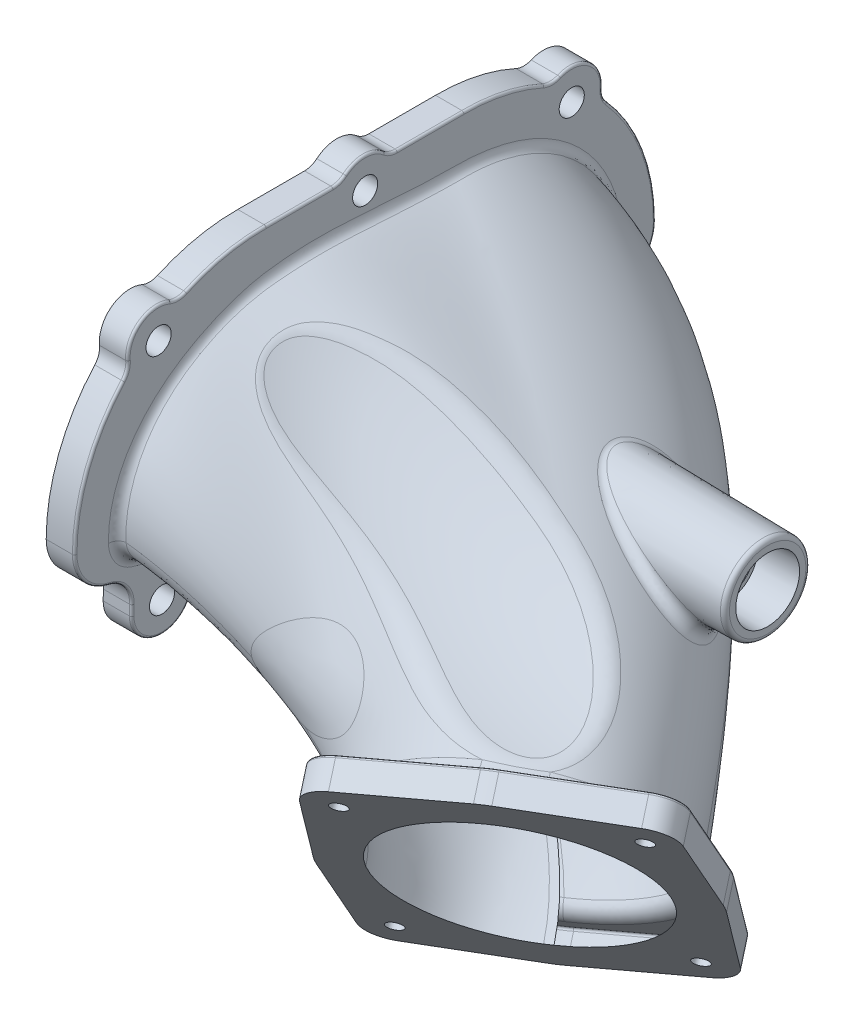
SolidWorks part; units mm, degrees
ref_plane "Front" through (0, 0, 0) normal (0, 0, 1) x (1, 0, 0)
ref_plane "Top" through (0, 0, 0) normal (0, 1, 0) x (1, 0, 0)
ref_plane "Right" through (0, 0, 0) normal (1, 0, 0) x (0, 0, -1)
imported_body "Surface-Imported1"
imported_body "Surface-Imported2"
surface "Surface-Fill5" [suppressed]
sketch3d "3DSketch1"
  spline S14 degree 3 poles (1005.4638, 90.7321, -1757.311) (-176.2378, 115.1326, 176.487) (-12.4549, 97.9545, -3.8592) (94.6916, 38.5251, 14.2017) (96.1386, 37.7085, 14.4851) (98.9931, 36.068, 15.1336) (100.4025, 35.2431, 15.4988) (103.1841, 33.5858, 16.3193) (104.5566, 32.753, 16.7732) (108.6137, 30.2506, 18.2931) (111.2382, 28.578, 19.5196) (114.417, 26.5056, 21.363) (115.0468, 26.0926, 21.7471) (116.2852, 25.2762, 22.5409) (116.895, 24.8721, 22.9515) (118.6963, 23.6727, 24.2255) (119.8596, 22.8907, 25.1307) (122.1072, 21.3685, 27.0627) (123.1917, 20.6282, 28.0894) (125.2731, 19.1973, 30.2798) (126.2703, 18.5067, 31.4433) (128.1603, 17.1843, 33.9339) (129.035, 16.5654, 35.2375) (130.6178, 15.421, 37.9714) (131.3253, 14.8961, 39.4036) (132.2375, 14.1784, 41.662) (132.5171, 13.9502, 42.4359) (133.0103, 13.5255, 43.9982) (133.2251, 13.3281, 44.7892) (133.5844, 12.9632, 46.3921) (133.729, 12.7957, 47.2041) (133.8862, 12.5672, 48.4392) (133.9286, 12.4949, 48.8538) (133.976, 12.392, 49.4803) (133.9885, 12.3592, 49.6901) (134.0124, 12.2923, 50.1097) (134.0215, 12.2599, 50.3203) (134.0757, 11.9802, 52.2119) (133.9337, 11.8097, 53.884) (133.459, 11.6801, 55.9556) (133.3491, 11.6585, 56.3678) (133.1013, 11.6237, 57.1782) (132.9631, 11.6105, 57.5776) (113.0604, 10.3877, 108.8555) (-149.8951, 72.9629, 63.1594) (-1742.5609, -341.9546, -528.6619) knots -4.473367 -4.473367 -4.473367 -4.473367 0.0625 0.0625 0.125 0.125 0.1875 0.1875 0.25 0.25 0.375 0.375 0.40625 0.40625 0.4375 0.4375 0.5 0.5 0.5625 0.5625 0.625 0.625 0.6875 0.6875 0.75 0.75 0.78125 0.78125 0.8125 0.8125 0.84375 0.84375 0.859375 0.859375 0.867188 0.867188 0.875 0.875 0.9375 0.9375 0.953125 0.953125 0.96875 0.96875 2.988263 2.988263 2.988263 2.988263 only from (88.8369, 41.7325, 13.3266) to (131.7147, 11.5886, 60.2624) construction
  spline S15 degree 3 poles (1560.0444, -661.8859, -1009.8542) (26.3725, 31.3471, 133.1526) (5.2586, 75.1866, 58.3706) (23.2367, 73.3857, 31.5766) (23.4803, 73.354, 31.2323) (24.2303, 73.2374, 30.2205) (24.756, 73.1315, 29.574) (25.8506, 72.8725, 28.3282) (26.4196, 72.7193, 27.729) (27.3025, 72.458, 26.8623) (27.6018, 72.3656, 26.5787) (28.21, 72.1708, 26.0221) (28.5195, 72.0682, 25.7486) (30.0778, 71.5359, 24.4174) (31.3663, 71.0467, 23.4616) (33.0243, 70.3889, 22.3739) (33.3585, 70.2548, 22.1623) (34.0279, 69.9853, 21.7414) (34.3635, 69.8494, 21.5331) (35.3731, 69.4377, 20.9156) (36.0499, 69.1576, 20.5135) (37.4115, 68.5833, 19.7318) (38.0963, 68.2889, 19.3521) (39.474, 67.6836, 18.6168) (40.1666, 67.3727, 18.2605) (41.566, 66.7301, 17.5848) (42.2737, 66.3984, 17.2631) (43.6907, 65.7228, 16.6563) (44.4007, 65.3786, 16.3707) (47.9588, 63.6305, 15.0236) (50.8316, 62.147, 14.204) (55.1842, 59.8589, 13.2549) (56.6423, 59.0854, 12.9857) (59.571, 57.522, 12.5248) (61.0437, 56.731, 12.3339) (63.9792, 55.1474, 12.027) (65.4445, 54.3529, 11.9073) (68.3718, 52.7631, 11.7587) (69.8341, 51.9681, 11.7282) (74.2204, 49.5883, 11.7467) (77.1445, 48.0096, 11.9033) (81.5313, 45.6524, 12.3078) (82.9935, 44.8683, 12.4714) (85.1859, 43.6926, 12.7596) (85.9165, 43.3007, 12.8628) (87.012, 42.7129, 13.0284) (87.5597, 42.4189, 13.114) (88.1984, 42.0757, 13.2186) (88.4721, 41.9286, 13.2645) (94.8892, 38.4791, 14.3491) (92.7862, 39.5725, 14.5385) (1829.9537, -894.8471, 313.9282) knots -1.15725 -1.15725 -1.15725 -1.15725 0.015625 0.015625 0.03125 0.03125 0.0625 0.0625 0.09375 0.09375 0.109375 0.109375 0.125 0.125 0.1875 0.1875 0.203125 0.203125 0.21875 0.21875 0.25 0.25 0.28125 0.28125 0.3125 0.3125 0.34375 0.34375 0.375 0.375 0.5 0.5 0.5625 0.5625 0.625 0.625 0.6875 0.6875 0.75 0.75 0.875 0.875 0.9375 0.9375 0.96875 0.96875 0.984375 0.992188 0.996094 0.996094 1.266983 1.266983 1.266983 1.266983 only from (22.3154, 73.4547, 33.0084) to (88.8369, 41.7325, 13.3266) construction
  spline S16 degree 3 number of poles 66 (90.3339, 16.9796, 64.9298) -> (22.3154, 73.4547, 33.0084) construction
  spline S17 degree 3 poles (614.0407, -516.8384, -1782.8452) (-67.2549, 673.7387, 1944.5989) (162.8848, -841.8006, -1736.3681) (-180.3872, 1157.455, 1676.758) knots -60.468019 -60.468019 -60.468019 -60.468019 62.622658 62.622658 62.622658 62.622658 only from (93.8118, 16.1005, 66.2329) to (90.3339, 16.9796, 64.9298) construction
  spline S18 degree 3 poles (179.8986, -144.845, -1921.1643) (226.4149, 10.6921, -73.3699) (172.0875, 6.9146, 70.0831) (110.741, 13.536, 69.7961) (109.7127, 13.6493, 69.7496) (107.6534, 13.8849, 69.5808) (106.631, 14.0074, 69.4579) (103.592, 14.3928, 68.9945) (101.5992, 14.6739, 68.5596) (98.6501, 15.1559, 67.7753) (97.6738, 15.3267, 67.4917) (96.2187, 15.6017, 67.0388) (95.7352, 15.6966, 66.8832) (95.0123, 15.844, 66.6438) (94.7717, 15.894, 66.563) (74.5226, 20.1867, 59.6677) (49.338, 32.4582, 43.4536) (1947.2505, -345.8185, 724.6333) knots -7.09543 -7.09543 -7.09543 -7.09543 0.25 0.25 0.375 0.375 0.5 0.5 0.75 0.75 0.875 0.875 0.9375 0.9375 0.96875 0.96875 3.571466 3.571466 3.571466 3.571466 only from (117.9019, 12.7895, 69.2687) to (93.8118, 16.1005, 66.2329) construction
  spline S19 degree 3 poles (-212.9602, -1941.9259, -165.3836) (128.9641, -35.1742, -86.7086) (169.434, 6.2954, 30.0082) (128.1146, 12.2402, 63.4948) (127.561, 12.3112, 63.9172) (126.4365, 12.4416, 64.726) (125.8645, 12.5011, 65.1136) (124.121, 12.6618, 66.2298) (122.9227, 12.7455, 66.9125) (67.2671, 14.7855, 95.3679) (-50.8018, -59.1415, 17.8966) (-282.9748, -1935.4604, -89.7529) knots -9.203255 -9.203255 -9.203255 -9.203255 0.25 0.25 0.375 0.375 0.5 0.5 0.75 0.75 11.806093 11.806093 11.806093 11.806093 only from (131.7147, 11.5886, 60.2624) to (117.9019, 12.7895, 69.2687) construction
  spline S20 degree 3 poles (88.8369, 41.7325, 13.3266) (90.3116, 40.9405, 13.5028) (91.779, 40.1406, 13.7107) (94.6916, 38.5251, 14.2017) (96.1386, 37.7085, 14.4851) (98.9931, 36.068, 15.1336) (100.4025, 35.2431, 15.4988) (103.1841, 33.5858, 16.3193) (104.5566, 32.753, 16.7732) (108.6137, 30.2506, 18.2931) (111.2382, 28.578, 19.5196) (114.417, 26.5056, 21.363) (115.0468, 26.0926, 21.7471) (116.2852, 25.2762, 22.5409) (116.895, 24.8721, 22.9515) (118.6963, 23.6727, 24.2255) (119.8596, 22.8907, 25.1307) (122.1072, 21.3685, 27.0627) (123.1917, 20.6282, 28.0894) (125.2731, 19.1973, 30.2798) (126.2703, 18.5067, 31.4433) (128.1603, 17.1843, 33.9339) (129.035, 16.5654, 35.2375) (130.6178, 15.421, 37.9714) (131.3253, 14.8961, 39.4036) (132.2375, 14.1784, 41.662) (132.5171, 13.9502, 42.4359) (133.0103, 13.5255, 43.9982) (133.2251, 13.3281, 44.7892) (133.5844, 12.9632, 46.3921) (133.729, 12.7957, 47.2041) (133.8862, 12.5672, 48.4392) (133.9286, 12.4949, 48.8538) (133.976, 12.392, 49.4803) (133.9885, 12.3592, 49.6901) (134.0124, 12.2923, 50.1097) (134.0215, 12.2599, 50.3203) (134.0757, 11.9802, 52.2119) (133.9337, 11.8097, 53.884) (133.459, 11.6801, 55.9556) (133.3491, 11.6585, 56.3678) (133.1013, 11.6237, 57.1782) (132.9631, 11.6105, 57.5776) (132.5047, 11.5824, 58.7587) (132.1408, 11.5789, 59.523) (131.7147, 11.5886, 60.2624) knots 0 0 0 0 0.0625 0.0625 0.125 0.125 0.1875 0.1875 0.25 0.25 0.375 0.375 0.40625 0.40625 0.4375 0.4375 0.5 0.5 0.5625 0.5625 0.625 0.625 0.6875 0.6875 0.75 0.75 0.78125 0.78125 0.8125 0.8125 0.84375 0.84375 0.859375 0.859375 0.867188 0.867188 0.875 0.875 0.9375 0.9375 0.953125 0.953125 0.96875 0.96875 1 1 1 1
  spline S21 degree 3 poles (22.3154, 73.4547, 33.0084) (22.5345, 73.4487, 32.642) (22.764, 73.4331, 32.2811) (23.2367, 73.3857, 31.5766) (23.4803, 73.354, 31.2323) (24.2303, 73.2374, 30.2205) (24.756, 73.1315, 29.574) (25.8506, 72.8725, 28.3282) (26.4196, 72.7193, 27.729) (27.3025, 72.458, 26.8623) (27.6018, 72.3656, 26.5787) (28.21, 72.1708, 26.0221) (28.5195, 72.0682, 25.7486) (30.0778, 71.5359, 24.4174) (31.3663, 71.0467, 23.4616) (33.0243, 70.3889, 22.3739) (33.3585, 70.2548, 22.1623) (34.0279, 69.9853, 21.7414) (34.3635, 69.8494, 21.5331) (35.3731, 69.4377, 20.9156) (36.0499, 69.1576, 20.5135) (37.4115, 68.5833, 19.7318) (38.0963, 68.2889, 19.3521) (39.474, 67.6836, 18.6168) (40.1666, 67.3727, 18.2605) (41.566, 66.7301, 17.5848) (42.2737, 66.3984, 17.2631) (43.6907, 65.7228, 16.6563) (44.4007, 65.3786, 16.3707) (47.9588, 63.6305, 15.0236) (50.8316, 62.147, 14.204) (55.1842, 59.8589, 13.2549) (56.6423, 59.0854, 12.9857) (59.571, 57.522, 12.5248) (61.0437, 56.731, 12.3339) (63.9792, 55.1474, 12.027) (65.4445, 54.3529, 11.9073) (68.3718, 52.7631, 11.7587) (69.8341, 51.9681, 11.7282) (74.2204, 49.5883, 11.7467) (77.1445, 48.0096, 11.9033) (81.5313, 45.6524, 12.3078) (82.9935, 44.8683, 12.4714) (85.1859, 43.6926, 12.7596) (85.9165, 43.3007, 12.8628) (87.012, 42.7129, 13.0284) (87.5597, 42.4189, 13.114) (88.1984, 42.0757, 13.2186) (88.4721, 41.9286, 13.2645) (88.6545, 41.8306, 13.2954) (88.744, 41.7825, 13.3106) (88.8369, 41.7325, 13.3266) knots 0 0 0 0 0.015625 0.015625 0.03125 0.03125 0.0625 0.0625 0.09375 0.09375 0.109375 0.109375 0.125 0.125 0.1875 0.1875 0.203125 0.203125 0.21875 0.21875 0.25 0.25 0.28125 0.28125 0.3125 0.3125 0.34375 0.34375 0.375 0.375 0.5 0.5 0.5625 0.5625 0.625 0.625 0.6875 0.6875 0.75 0.75 0.875 0.875 0.9375 0.9375 0.96875 0.96875 0.984375 0.992188 0.996094 0.996094 1 1 1 1
  spline S22 degree 3 number of poles 66 (90.3339, 16.9796, 64.9298) -> (22.3154, 73.4547, 33.0084)
  spline S23 degree 3 poles (93.8118, 16.1005, 66.2329) (92.6408, 16.3693, 65.8147) (91.4817, 16.6612, 65.3777) (90.3339, 16.9796, 64.9298) knots 0 0 0 0 1 1 1 1
  spline S24 degree 3 poles (117.9019, 12.7895, 69.2687) (115.8665, 12.9939, 69.6536) (113.8205, 13.2036, 69.8105) (110.741, 13.536, 69.7961) (109.7127, 13.6493, 69.7496) (107.6534, 13.8849, 69.5808) (106.631, 14.0074, 69.4579) (103.592, 14.3928, 68.9945) (101.5992, 14.6739, 68.5596) (98.6501, 15.1559, 67.7753) (97.6738, 15.3267, 67.4917) (96.2187, 15.6017, 67.0388) (95.7352, 15.6966, 66.8832) (95.0123, 15.844, 66.6438) (94.7717, 15.894, 66.563) (94.2912, 15.9959, 66.3993) (94.0502, 16.048, 66.3162) (93.8118, 16.1005, 66.2329) knots 0 0 0 0 0.25 0.25 0.375 0.375 0.5 0.5 0.75 0.75 0.875 0.875 0.9375 0.9375 0.96875 0.96875 1 1 1 1
  spline S25 degree 3 poles (131.7147, 11.5886, 60.2624) (130.754, 11.8274, 61.2513) (129.7323, 12.0075, 62.1838) (128.1146, 12.2402, 63.4948) (127.561, 12.3112, 63.9172) (126.4365, 12.4416, 64.726) (125.8645, 12.5011, 65.1136) (124.121, 12.6618, 66.2298) (122.9227, 12.7455, 66.9125) (120.4614, 12.8357, 68.1709) (119.1982, 12.842, 68.7463) (117.9019, 12.7895, 69.2687) knots 0 0 0 0 0.25 0.25 0.375 0.375 0.5 0.5 0.75 0.75 1 1 1 1
sketch3d "3DSketch2" [suppressed]
  spline S1 degree 3 number of poles 83 (94.4414, 20.1638, 58.2469) -> (94.4414, 20.1638, 58.2469)
  spline S2 degree 3 number of poles 83 (94.4414, 20.1638, 58.2469) -> (94.4414, 20.1638, 58.2469)
  dimension "D1" = 0
surface "Surface-Fill6" [suppressed]
other "DeleteFace1"
surface "Surface-Fill7"
surface "Surface-Fill8"
sketch3d "3DSketch3"
  spline S0 degree 3 poles (1560.0444, -661.8859, -1009.8542) (26.3725, 31.3471, 133.1526) (5.2586, 75.1866, 58.3706) (23.2367, 73.3857, 31.5766) (23.4803, 73.354, 31.2323) (24.2303, 73.2374, 30.2205) (24.756, 73.1315, 29.574) (25.8506, 72.8725, 28.3282) (26.4196, 72.7193, 27.729) (27.3025, 72.458, 26.8623) (27.6018, 72.3656, 26.5787) (28.21, 72.1708, 26.0221) (28.5195, 72.0682, 25.7486) (30.0778, 71.5359, 24.4174) (31.3663, 71.0467, 23.4616) (33.0243, 70.3889, 22.3739) (33.3585, 70.2548, 22.1623) (34.0279, 69.9853, 21.7414) (34.3635, 69.8494, 21.5331) (35.3731, 69.4377, 20.9156) (36.0499, 69.1576, 20.5135) (37.4115, 68.5833, 19.7318) (38.0963, 68.2889, 19.3521) (39.474, 67.6836, 18.6168) (40.1666, 67.3727, 18.2605) (41.566, 66.7301, 17.5848) (42.2737, 66.3984, 17.2631) (43.6907, 65.7228, 16.6563) (44.4007, 65.3786, 16.3707) (47.9588, 63.6305, 15.0236) (50.8316, 62.147, 14.204) (55.1842, 59.8589, 13.2549) (56.6423, 59.0854, 12.9857) (59.571, 57.522, 12.5248) (61.0437, 56.731, 12.3339) (63.9792, 55.1474, 12.027) (65.4445, 54.3529, 11.9073) (68.3718, 52.7631, 11.7587) (69.8341, 51.9681, 11.7282) (74.2204, 49.5883, 11.7467) (77.1445, 48.0096, 11.9033) (81.5313, 45.6524, 12.3078) (82.9935, 44.8683, 12.4714) (85.1859, 43.6926, 12.7596) (85.9165, 43.3007, 12.8628) (87.012, 42.7129, 13.0284) (87.5597, 42.4189, 13.114) (88.1984, 42.0757, 13.2186) (88.4721, 41.9286, 13.2645) (94.8892, 38.4791, 14.3491) (92.7862, 39.5725, 14.5385) (1829.9537, -894.8471, 313.9282) knots -1.15725 -1.15725 -1.15725 -1.15725 0.015625 0.015625 0.03125 0.03125 0.0625 0.0625 0.09375 0.09375 0.109375 0.109375 0.125 0.125 0.1875 0.1875 0.203125 0.203125 0.21875 0.21875 0.25 0.25 0.28125 0.28125 0.3125 0.3125 0.34375 0.34375 0.375 0.375 0.5 0.5 0.5625 0.5625 0.625 0.625 0.6875 0.6875 0.75 0.75 0.875 0.875 0.9375 0.9375 0.96875 0.96875 0.984375 0.992188 0.996094 0.996094 1.266983 1.266983 1.266983 1.266983 only from (22.3154, 73.4547, 33.0084) to (88.8369, 41.7325, 13.3266) construction
  spline S1 degree 3 poles (1005.4638, 90.7321, -1757.311) (-176.2378, 115.1326, 176.487) (-12.4549, 97.9545, -3.8592) (94.6916, 38.5251, 14.2017) (96.1386, 37.7085, 14.4851) (98.9931, 36.068, 15.1336) (100.4025, 35.2431, 15.4988) (103.1841, 33.5858, 16.3193) (104.5566, 32.753, 16.7732) (108.6137, 30.2506, 18.2931) (111.2382, 28.578, 19.5196) (114.417, 26.5056, 21.363) (115.0468, 26.0926, 21.7471) (116.2852, 25.2762, 22.5409) (116.895, 24.8721, 22.9515) (118.6963, 23.6727, 24.2255) (119.8596, 22.8907, 25.1307) (122.1072, 21.3685, 27.0627) (123.1917, 20.6282, 28.0894) (125.2731, 19.1973, 30.2798) (126.2703, 18.5067, 31.4433) (128.1603, 17.1843, 33.9339) (129.035, 16.5654, 35.2375) (130.6178, 15.421, 37.9714) (131.3253, 14.8961, 39.4036) (132.2375, 14.1784, 41.662) (132.5171, 13.9502, 42.4359) (133.0103, 13.5255, 43.9982) (133.2251, 13.3281, 44.7892) (133.5844, 12.9632, 46.3921) (133.729, 12.7957, 47.2041) (133.8862, 12.5672, 48.4392) (133.9286, 12.4949, 48.8538) (133.976, 12.392, 49.4803) (133.9885, 12.3592, 49.6901) (134.0124, 12.2923, 50.1097) (134.0215, 12.2599, 50.3203) (134.0757, 11.9802, 52.2119) (133.9337, 11.8097, 53.884) (133.459, 11.6801, 55.9556) (133.3491, 11.6585, 56.3678) (133.1013, 11.6237, 57.1782) (132.9631, 11.6105, 57.5776) (113.0604, 10.3877, 108.8555) (-149.8951, 72.9629, 63.1594) (-1742.5609, -341.9546, -528.6619) knots -4.473367 -4.473367 -4.473367 -4.473367 0.0625 0.0625 0.125 0.125 0.1875 0.1875 0.25 0.25 0.375 0.375 0.40625 0.40625 0.4375 0.4375 0.5 0.5 0.5625 0.5625 0.625 0.625 0.6875 0.6875 0.75 0.75 0.78125 0.78125 0.8125 0.8125 0.84375 0.84375 0.859375 0.859375 0.867188 0.867188 0.875 0.875 0.9375 0.9375 0.953125 0.953125 0.96875 0.96875 2.988263 2.988263 2.988263 2.988263 only from (88.8369, 41.7325, 13.3266) to (131.7147, 11.5886, 60.2624) construction
  spline S2 degree 3 number of poles 66 (90.3339, 16.9796, 64.9298) -> (22.3154, 73.4547, 33.0084) construction
  spline S3 degree 3 poles (614.0407, -516.8384, -1782.8452) (-67.2549, 673.7387, 1944.5989) (162.8848, -841.8006, -1736.3681) (-180.3872, 1157.455, 1676.758) knots -60.468019 -60.468019 -60.468019 -60.468019 62.622658 62.622658 62.622658 62.622658 only from (93.8118, 16.1005, 66.2329) to (90.3339, 16.9796, 64.9298) construction
  spline S4 degree 3 poles (179.8986, -144.845, -1921.1643) (226.4149, 10.6921, -73.3699) (172.0875, 6.9146, 70.0831) (110.741, 13.536, 69.7961) (109.7127, 13.6493, 69.7496) (107.6534, 13.8849, 69.5808) (106.631, 14.0074, 69.4579) (103.592, 14.3928, 68.9945) (101.5992, 14.6739, 68.5596) (98.6501, 15.1559, 67.7753) (97.6738, 15.3267, 67.4917) (96.2187, 15.6017, 67.0388) (95.7352, 15.6966, 66.8832) (95.0123, 15.844, 66.6438) (94.7717, 15.894, 66.563) (74.5226, 20.1867, 59.6677) (49.338, 32.4582, 43.4536) (1947.2505, -345.8185, 724.6333) knots -7.09543 -7.09543 -7.09543 -7.09543 0.25 0.25 0.375 0.375 0.5 0.5 0.75 0.75 0.875 0.875 0.9375 0.9375 0.96875 0.96875 3.571466 3.571466 3.571466 3.571466 only from (117.9019, 12.7895, 69.2687) to (93.8118, 16.1005, 66.2329) construction
  spline S5 degree 3 poles (-212.9602, -1941.9259, -165.3836) (128.9641, -35.1742, -86.7086) (169.434, 6.2954, 30.0082) (128.1146, 12.2402, 63.4948) (127.561, 12.3112, 63.9172) (126.4365, 12.4416, 64.726) (125.8645, 12.5011, 65.1136) (124.121, 12.6618, 66.2298) (122.9227, 12.7455, 66.9125) (67.2671, 14.7855, 95.3679) (-50.8018, -59.1415, 17.8966) (-282.9748, -1935.4604, -89.7529) knots -9.203255 -9.203255 -9.203255 -9.203255 0.25 0.25 0.375 0.375 0.5 0.5 0.75 0.75 11.806093 11.806093 11.806093 11.806093 only from (131.7147, 11.5886, 60.2624) to (117.9019, 12.7895, 69.2687) construction
  spline S6 degree 3 poles (22.3154, 73.4547, 33.0084) (22.5345, 73.4487, 32.642) (22.764, 73.4331, 32.2811) (23.2367, 73.3857, 31.5766) (23.4803, 73.354, 31.2323) (24.2303, 73.2374, 30.2205) (24.756, 73.1315, 29.574) (25.8506, 72.8725, 28.3282) (26.4196, 72.7193, 27.729) (27.3025, 72.458, 26.8623) (27.6018, 72.3656, 26.5787) (28.21, 72.1708, 26.0221) (28.5195, 72.0682, 25.7486) (30.0778, 71.5359, 24.4174) (31.3663, 71.0467, 23.4616) (33.0243, 70.3889, 22.3739) (33.3585, 70.2548, 22.1623) (34.0279, 69.9853, 21.7414) (34.3635, 69.8494, 21.5331) (35.3731, 69.4377, 20.9156) (36.0499, 69.1576, 20.5135) (37.4115, 68.5833, 19.7318) (38.0963, 68.2889, 19.3521) (39.474, 67.6836, 18.6168) (40.1666, 67.3727, 18.2605) (41.566, 66.7301, 17.5848) (42.2737, 66.3984, 17.2631) (43.6907, 65.7228, 16.6563) (44.4007, 65.3786, 16.3707) (47.9588, 63.6305, 15.0236) (50.8316, 62.147, 14.204) (55.1842, 59.8589, 13.2549) (56.6423, 59.0854, 12.9857) (59.571, 57.522, 12.5248) (61.0437, 56.731, 12.3339) (63.9792, 55.1474, 12.027) (65.4445, 54.3529, 11.9073) (68.3718, 52.7631, 11.7587) (69.8341, 51.9681, 11.7282) (74.2204, 49.5883, 11.7467) (77.1445, 48.0096, 11.9033) (81.5313, 45.6524, 12.3078) (82.9935, 44.8683, 12.4714) (85.1859, 43.6926, 12.7596) (85.9165, 43.3007, 12.8628) (87.012, 42.7129, 13.0284) (87.5597, 42.4189, 13.114) (88.1984, 42.0757, 13.2186) (88.4721, 41.9286, 13.2645) (88.6545, 41.8306, 13.2954) (88.744, 41.7825, 13.3106) (88.8369, 41.7325, 13.3266) knots 0 0 0 0 0.015625 0.015625 0.03125 0.03125 0.0625 0.0625 0.09375 0.09375 0.109375 0.109375 0.125 0.125 0.1875 0.1875 0.203125 0.203125 0.21875 0.21875 0.25 0.25 0.28125 0.28125 0.3125 0.3125 0.34375 0.34375 0.375 0.375 0.5 0.5 0.5625 0.5625 0.625 0.625 0.6875 0.6875 0.75 0.75 0.875 0.875 0.9375 0.9375 0.96875 0.96875 0.984375 0.992188 0.996094 0.996094 1 1 1 1
  spline S7 degree 3 poles (88.8369, 41.7325, 13.3266) (90.3116, 40.9405, 13.5028) (91.779, 40.1406, 13.7107) (94.6916, 38.5251, 14.2017) (96.1386, 37.7085, 14.4851) (98.9931, 36.068, 15.1336) (100.4025, 35.2431, 15.4988) (103.1841, 33.5858, 16.3193) (104.5566, 32.753, 16.7732) (108.6137, 30.2506, 18.2931) (111.2382, 28.578, 19.5196) (114.417, 26.5056, 21.363) (115.0468, 26.0926, 21.7471) (116.2852, 25.2762, 22.5409) (116.895, 24.8721, 22.9515) (118.6963, 23.6727, 24.2255) (119.8596, 22.8907, 25.1307) (122.1072, 21.3685, 27.0627) (123.1917, 20.6282, 28.0894) (125.2731, 19.1973, 30.2798) (126.2703, 18.5067, 31.4433) (128.1603, 17.1843, 33.9339) (129.035, 16.5654, 35.2375) (130.6178, 15.421, 37.9714) (131.3253, 14.8961, 39.4036) (132.2375, 14.1784, 41.662) (132.5171, 13.9502, 42.4359) (133.0103, 13.5255, 43.9982) (133.2251, 13.3281, 44.7892) (133.5844, 12.9632, 46.3921) (133.729, 12.7957, 47.2041) (133.8862, 12.5672, 48.4392) (133.9286, 12.4949, 48.8538) (133.976, 12.392, 49.4803) (133.9885, 12.3592, 49.6901) (134.0124, 12.2923, 50.1097) (134.0215, 12.2599, 50.3203) (134.0757, 11.9802, 52.2119) (133.9337, 11.8097, 53.884) (133.459, 11.6801, 55.9556) (133.3491, 11.6585, 56.3678) (133.1013, 11.6237, 57.1782) (132.9631, 11.6105, 57.5776) (132.5047, 11.5824, 58.7587) (132.1408, 11.5789, 59.523) (131.7147, 11.5886, 60.2624) knots 0 0 0 0 0.0625 0.0625 0.125 0.125 0.1875 0.1875 0.25 0.25 0.375 0.375 0.40625 0.40625 0.4375 0.4375 0.5 0.5 0.5625 0.5625 0.625 0.625 0.6875 0.6875 0.75 0.75 0.78125 0.78125 0.8125 0.8125 0.84375 0.84375 0.859375 0.859375 0.867188 0.867188 0.875 0.875 0.9375 0.9375 0.953125 0.953125 0.96875 0.96875 1 1 1 1
  spline S8 degree 3 number of poles 66 (90.3339, 16.9796, 64.9298) -> (22.3154, 73.4547, 33.0084)
  spline S9 degree 3 poles (93.8118, 16.1005, 66.2329) (92.6408, 16.3693, 65.8147) (91.4817, 16.6612, 65.3777) (90.3339, 16.9796, 64.9298) knots 0 0 0 0 1 1 1 1
  spline S10 degree 3 poles (117.9019, 12.7895, 69.2687) (115.8665, 12.9939, 69.6536) (113.8205, 13.2036, 69.8105) (110.741, 13.536, 69.7961) (109.7127, 13.6493, 69.7496) (107.6534, 13.8849, 69.5808) (106.631, 14.0074, 69.4579) (103.592, 14.3928, 68.9945) (101.5992, 14.6739, 68.5596) (98.6501, 15.1559, 67.7753) (97.6738, 15.3267, 67.4917) (96.2187, 15.6017, 67.0388) (95.7352, 15.6966, 66.8832) (95.0123, 15.844, 66.6438) (94.7717, 15.894, 66.563) (94.2912, 15.9959, 66.3993) (94.0502, 16.048, 66.3162) (93.8118, 16.1005, 66.2329) knots 0 0 0 0 0.25 0.25 0.375 0.375 0.5 0.5 0.75 0.75 0.875 0.875 0.9375 0.9375 0.96875 0.96875 1 1 1 1
  spline S11 degree 3 poles (131.7147, 11.5886, 60.2624) (130.754, 11.8274, 61.2513) (129.7323, 12.0075, 62.1838) (128.1146, 12.2402, 63.4948) (127.561, 12.3112, 63.9172) (126.4365, 12.4416, 64.726) (125.8645, 12.5011, 65.1136) (124.121, 12.6618, 66.2298) (122.9227, 12.7455, 66.9125) (120.4614, 12.8357, 68.1709) (119.1982, 12.842, 68.7463) (117.9019, 12.7895, 69.2687) knots 0 0 0 0 0.25 0.25 0.375 0.375 0.5 0.5 0.75 0.75 1 1 1 1
surface "Surface-Fill9" [suppressed]
surface "Surface-Fill10"
surface "Surface-Knit3"
surface "Surface-Knit4"
surface "Surface-Knit5"
surface "Surface-Knit6"
